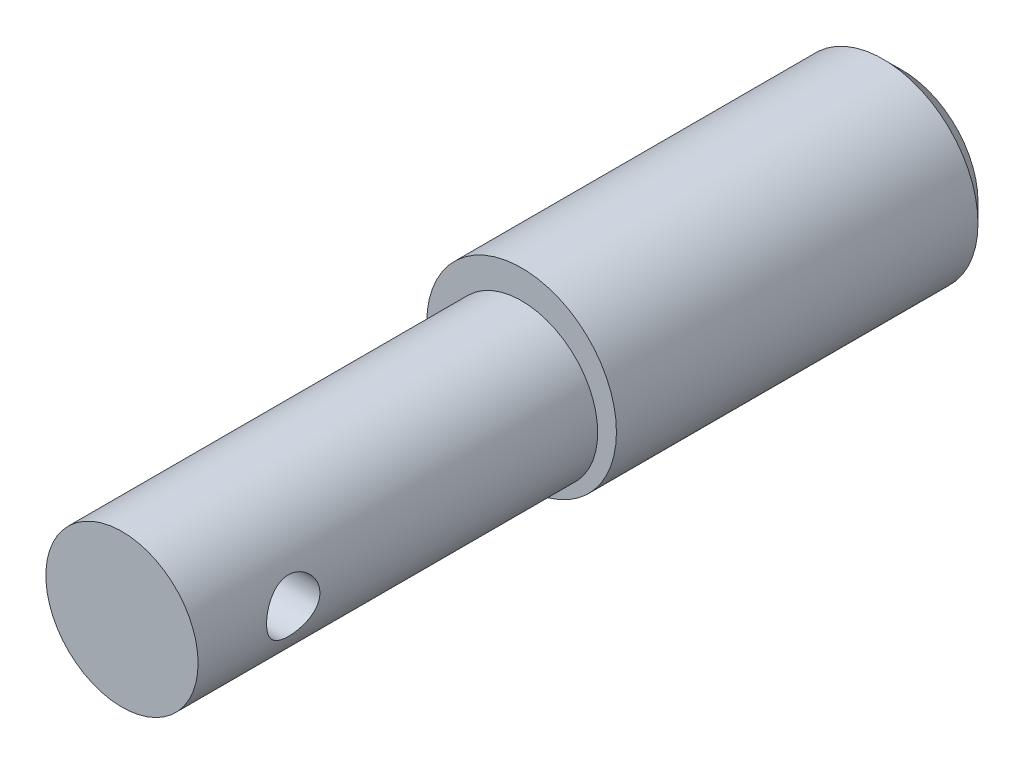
SolidWorks part; units mm, degrees
ref_plane "Front" through (0, 0, 0) normal (0, 0, 1) x (1, 0, 0)
ref_plane "Top" through (0, 0, 0) normal (0, 1, 0) x (1, 0, 0)
ref_plane "Right" through (0, 0, 0) normal (1, 0, 0) x (0, 0, -1)
sketch "Sketch1" plane through (0, 0, 0) normal (0, 0, 1) x (1, 0, 0)
  circle A0 centre (0, 0) radius 3.956
  dimension "D1" = 7.9121
extrude "Base-Extrude" add sketch "Sketch1" along normal mid plane 32.5437
chamfer "Chamfer1" distance 0.7937 angle 45 1 edges at (3.956, 0, -16.2719)
sketch "Silhouette" plane through (0, 0, 0) normal (1, 0, 0) x (0, 0, -1)
  line L1 (-16.2719, 2.7686) -> (0.3969, 2.7686)
  line L2 (-13.5156, -0.4064) -> (-0.4661, -0.4064) construction
  line L3 (-16.2719, 2.7686) -> (-16.2719, 3.9561)
  line L4 (50, 0) -> (-50, 0) construction
  line L5 (0.3969, 3.956) -> (-16.2719, 3.9561)
  line L6 (0.3969, 3.956) -> (0.3969, 2.7686)
  line L7 (-16.2719, 3.956) -> (-16.2719, -3.956) construction
  line L9 (16.2719, -3.1623) -> (16.2719, 3.1623) construction
  line L10 (15.4781, 3.956) -> (-16.2719, 3.956) construction
  dimension "D1" = 0.4064
  dimension "D2" = 6.35
  dimension "D3" = 15.875
revolve "Cut-Revolve1" cut sketch "Silhouette" angle 360 about L2
sketch "Sketch5" plane through (0, 0, 0) normal (1, 0, 0) x (0, 0, -1)
  line L1 (-16.2719, 3.956) -> (-16.2719, -3.956) construction
  line L2 (0.3969, -0.4064) -> (-16.2719, -0.4064) construction
  circle A0 centre (-12.3031, -0.4064) radius 1.1122
  dimension "D1" = 2.2243
  dimension "D2" = 3.9688
extrude "Locking pin hole" cut sketch "Sketch5" against normal through all and the other way through all
